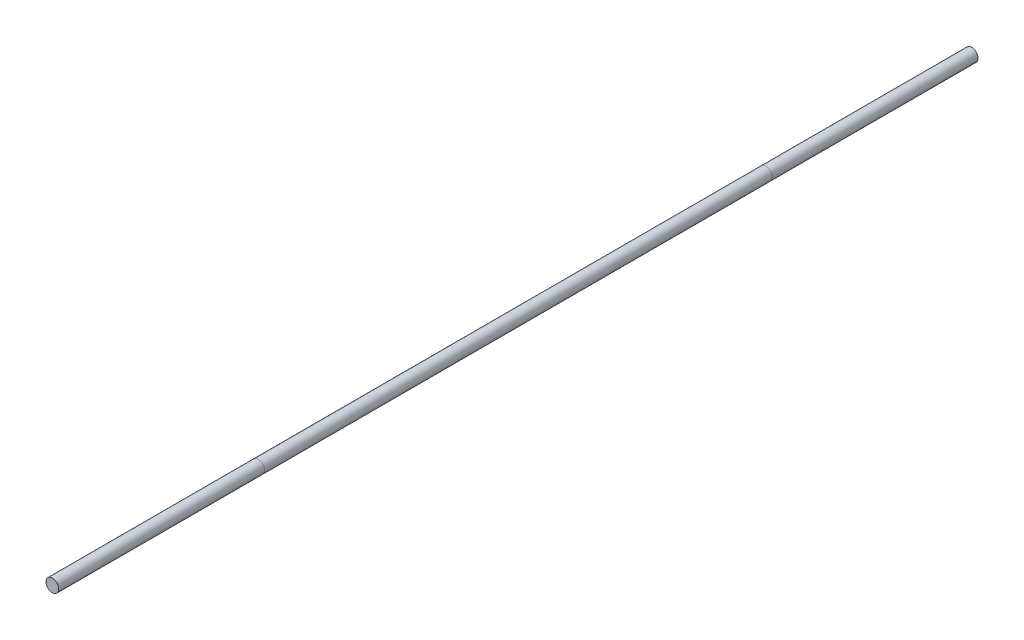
SolidWorks part; units mm, degrees
ref_plane "Front" through (0, 0, 0) normal (0, 0, 1) x (1, 0, 0)
ref_plane "Top" through (0, 0, 0) normal (0, 1, 0) x (1, 0, 0)
ref_plane "Right" through (0, 0, 0) normal (1, 0, 0) x (0, 0, -1)
sketch "Sketch1" plane through (0, 0, 0) normal (0, 0, 1) x (1, 0, 0)
  circle A2 centre (0, 0) radius 3.175
  dimension "D1" = 6.35
extrude "Base-Extrude" add sketch "Sketch1" along normal mid plane 460
ref_plane "Plane1" through (0, 0, -127) normal (0, 0, 1) x (1, 0, 0)
ref_plane "Plane2" through (0, 0, 127) normal (0, 0, 1) x (1, 0, 0)
